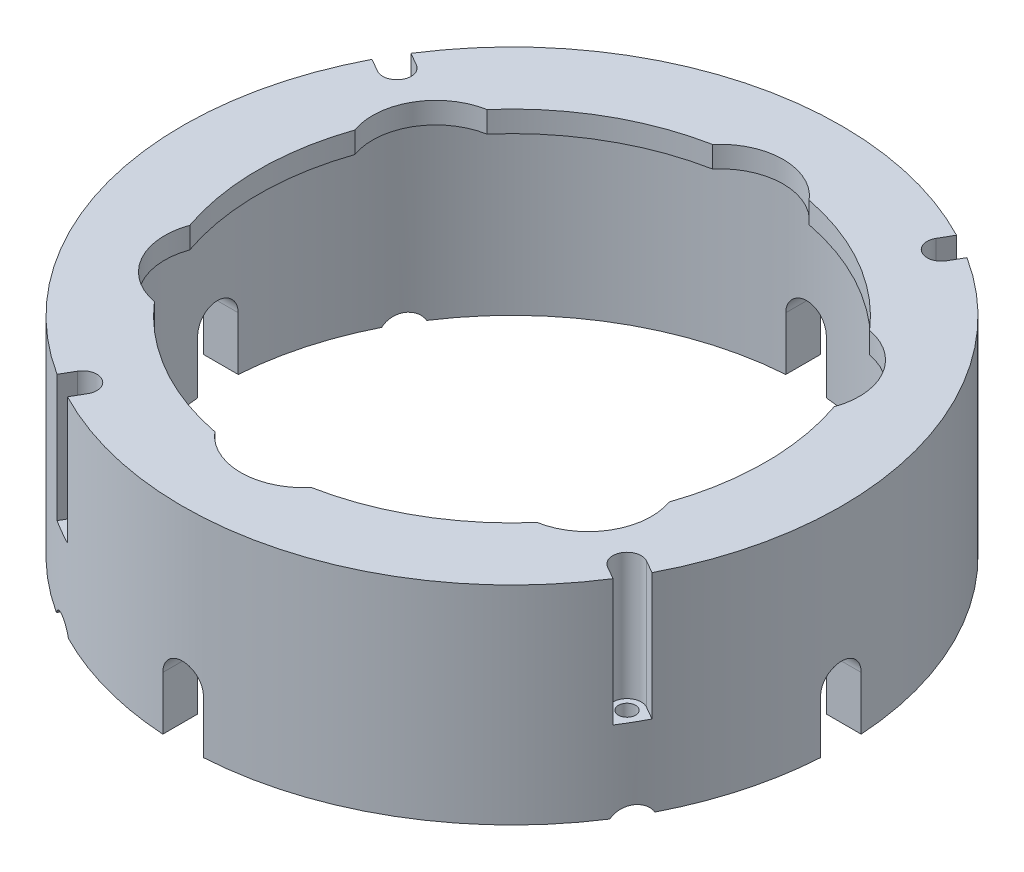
SolidWorks part; units mm, degrees
ref_plane "Front Plane" through (0, 0, 0) normal (0, 0, 1) x (1, 0, 0)
ref_plane "Top Plane" through (0, 0, 0) normal (0, 1, 0) x (1, 0, 0)
ref_plane "Right Plane" through (0, 0, 0) normal (1, 0, 0) x (0, 0, -1)
sketch "Sketch1" plane through (0, 0, 0) normal (0, 0, 1) x (1, 0, 0)
  line L0 (-63.5, 0) -> (-82.55, 0)
  line L1 (-82.55, 0) -> (-82.55, -52.07)
  line L2 (-82.55, -52.07) -> (-73.8378, -52.07)
  line L3 (-73.8378, -52.07) -> (-73.8378, -5.334)
  line L4 (-73.8378, -5.334) -> (-63.5, -5.334)
  line L5 (-63.5, -5.334) -> (-63.5, 0)
  line L6 (0, 0) -> (0, 38.1465) construction
  point P5 (-73.025, 0)
  dimension "D1" = 165.1
  dimension "D2" = 5.334
  dimension "D3" = 147.6756
  dimension "D4" = 46.736
  dimension "D5" = 127
  dimension "D6" = 52.07
ref_axis "Axis1" through (0, -5.4388, 0) along (0, -1, 0)
revolve "Revolve1" add sketch "Sketch1" angle 360 about axis through (0, -5.4388, 0) along (0, -1, 0)
hole_wizard "CSK for #6 Flat Head Machine Screw (100)1" positions "Sketch2" profile "Sketch3" countersink size "#6" standard "ANSI Inch"
sketch "Sketch2" plane through (0, 0, 0) normal (0, 1, 0) x (1, 0, 0)
  line L0 (0, 0) -> (-100.1909, 0) construction
  line L1 (-68.1908, 39.37) -> (0, 0) construction
  line L2 (0, 0) -> (90.2514, 0) construction
  line L3 (0, 0) -> (68.1908, -39.37) construction
  line L4 (0, 0) -> (39.37, 68.1908) construction
  line L5 (0, 0) -> (-39.37, -68.1908) construction
  circle A0 centre (0, 0) radius 78.74 construction
  point P0 (39.37, 68.1908)
  point P3 (39.37, 68.1908)
  point P5 (68.1908, -39.37)
  point P8 (-39.37, -68.1908)
  point P11 (-68.1908, 39.37)
  dimension "D1" = 157.48
  dimension "D2" = 30
  dimension "D3" = 30
  dimension "D4" = 60
  dimension "D5" = 60
sketch "Sketch3" plane through (39.37, 0, -68.1908) normal (1, 0, 0) x (0, 0, 1)
  line L0 (0, 0) -> (0, 52.07)
  line L1 (0, 52.07) -> (1.8986, 52.07)
  line L2 (1.8986, 52.07) -> (1.8986, 1.38)
  line L3 (1.8986, 1.38) -> (3.5433, 0)
  line L5 (3.5433, 0) -> (0, 0)
  line L6 (-1.8986, 1.38) -> (-3.5433, 0) construction
  line L11 (0, -6.35) -> (0, 107.95) construction
  dimension "Thru Hole Dia." = 3.7973
  dimension "Thru Hole Depth" = 52.07
  dimension "Near C'Sink Dia." = 7.0866
  dimension "Near C'Sink Angle" = 100
sketch "Sketch4" plane through (0, 0, 0) normal (0, 1, 0) x (1, 0, 0)
  circle A0 centre (0, 78.74) radius 3.175
  circle A1 centre (0, 0) radius 78.74
  dimension "D1" = 6.35
  dimension "D2" = 157.48
ref_plane "Plane2" through (0, 0, 0) normal (-0.5, 0, 0.866) x (0, -1, 0)
sketch "Sketch7" plane through (0, 0, 0) normal (-0.5, 0, 0.866) x (0, -1, 0)
  line L0 (5.4388, 0) -> (61.3188, 0) construction
  line L1 (52.07, -82.55) -> (52.07, 82.55) construction
  circle A0 centre (54.4512, 0) radius 4.7625
  dimension "D3" = 9.525
  dimension "D1" = 54.4512
  dimension "D2" = 2.3812
extrude "Cut-Extrude3" cut sketch "Sketch7" against normal through all
ref_plane "Plane1" through (0, 0, -82.55) normal (0, 0, -1) x (-1, 0, 0)
sketch "Sketch5" plane through (0, 0, -82.55) normal (0, 0, -1) x (-1, 0, 0)
  line L0 (0, -57.7346) -> (0, -38.6732) construction
  line L2 (-5.08, -57.7346) -> (-5.08, -38.6732)
  line L3 (5.08, -57.7346) -> (5.08, -38.6732)
  line L4 (0, -5.4388) -> (0, -61.3188) construction
  arc A0 (-5.08, -57.7346) -> (5.08, -57.7346) centre (0, -57.7346) ccw
  arc A1 (5.08, -38.6732) -> (-5.08, -38.6732) centre (0, -38.6732) ccw
  point P5 (0, -48.2039)
  dimension "D1" = 38.6732
  dimension "D2" = 10.16
extrude "Cut-Extrude1" cut sketch "Sketch5" against normal blind 12.7
pattern_circular "CirPattern1" count 4 over 360 about axis through (0, 0, 0) along (0, 1, 0) of "Cut-Extrude1", "Cut-Extrude3"
sketch "Sketch6" plane through (0, 0, 0) normal (0, 1, 0) x (1, 0, 0)
  line L0 (0, 0) -> (-94.4922, 0) construction
  line L5 (-45.0939, 26.035) -> (0, 0) construction
  circle A0 centre (-45.0939, 26.035) radius 15.875
  circle A3 centre (0, 0) radius 52.07 construction
  point P4 (0, 0)
  dimension "D2" = 31.75
  dimension "D1" = 30
  dimension "D3" = 104.14
extrude "Cut-Extrude2" cut sketch "Sketch6" against normal through all
pattern_circular "CirPattern2" count 6 over 360 about axis through (0, 0, 0) along (0, 1, 0) of "Cut-Extrude2"
sketch "Sketch11" plane through (0, 0, 0) normal (0, 1, 0) x (1, 0, 0)
  line L0 (0, 0) -> (105.0372, 0) construction
  line L1 (0, 0) -> (68.1908, -39.37) construction
  circle A0 centre (68.1908, -39.37) radius 2.159
  circle A1 centre (0, 0) radius 78.74 construction
  dimension "D1" = 4.318
  dimension "D3" = 157.48
  dimension "D2" = 30
extrude "Cut-Extrude5" cut sketch "Sketch11" against normal through all
sketch "Sketch10" plane through (0, 0, 0) normal (0, 1, 0) x (1, 0, 0)
  line L0 (0, 0) -> (104.6306, 0) construction
  line L1 (0, 0) -> (68.1908, -39.37) construction
  line L2 (69.9768, -36.2767) -> (87.6197, -46.4628)
  line L3 (66.4049, -42.4633) -> (82.5847, -51.8047)
  line L4 (82.5847, -51.8047) -> (87.6197, -46.4628)
  arc A0 (69.9768, -36.2767) -> (66.4049, -42.4633) centre (68.1908, -39.37) ccw
  circle A1 centre (0, 0) radius 78.74 construction
  dimension "D2" = 157.48
  dimension "D3" = 3.5719
  dimension "D1" = 30
extrude "Cut-Extrude4" cut sketch "Sketch10" against normal blind 31.75
pattern_circular "CirPattern3" count 4 over 360 about axis through (0, 0, 0) along (0, 1, 0) of "Cut-Extrude5", "Cut-Extrude4"
equation "\"Air Weight\"= \"SW-Mass\""
equation "\"Buoyancy\"= \"SW-Volume\" * ( \"SW-Density\" - .037062 )"
